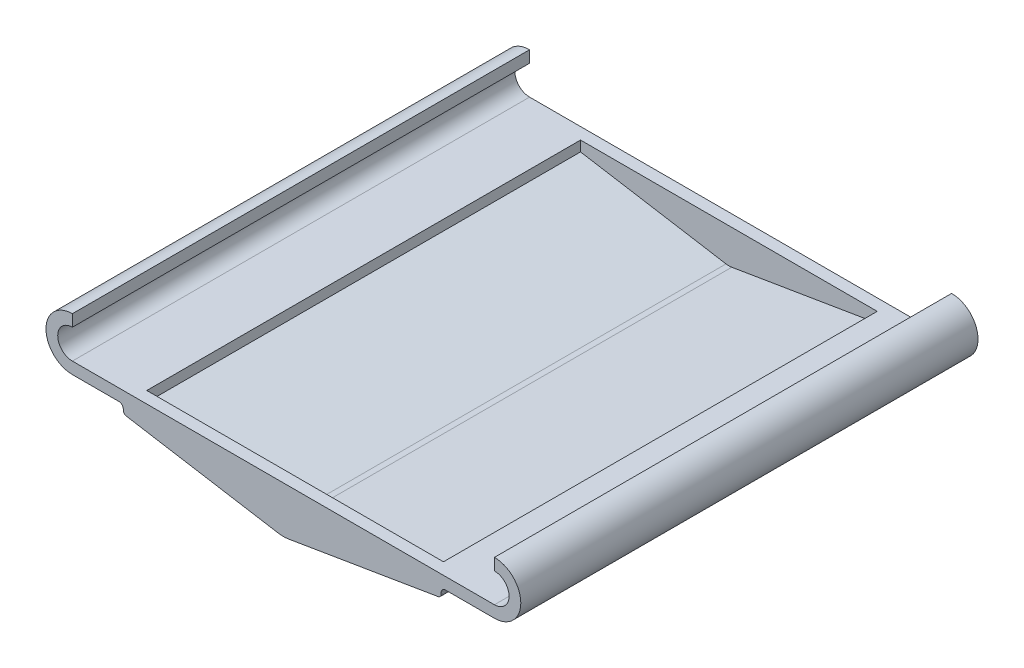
SolidWorks part; units mm, degrees
ref_plane "Plan1" through (0, 0, 0) normal (0, 0, 1) x (1, 0, 0)
ref_plane "Plan2" through (0, 0, 0) normal (0, 1, 0) x (1, 0, 0)
ref_plane "Plan3" through (0, 0, 0) normal (1, 0, 0) x (0, 0, -1)
sketch "Esquisse1" plane through (0, 0, 0) normal (0, 0, 1) x (1, 0, 0)
  line L0 (-7, -36.5) -> (-7, -35) construction
  line L1 (-7, -36.5) -> (-7, -35) construction
  line L2 (-7.5, -34.5) -> (-8.5, -34.5) construction
  line L3 (-7.5, -34.5) -> (-8.5, -34.5) construction
  line L4 (-8.5, -37) -> (-7.5, -37) construction
  line L5 (-8.5, -37) -> (-7.5, -37) construction
  line L6 (-9, -38) -> (-9, -37.5) construction
  line L7 (-9, -38) -> (-9, -37.5) construction
  line L8 (27, -35) -> (27, -36.5) construction
  line L9 (27, -35) -> (27, -36.5) construction
  line L10 (29, -37.5) -> (29, -38) construction
  line L11 (29, -37.5) -> (29, -38) construction
  line L12 (28.5, -37) -> (27.5, -37) construction
  line L13 (28.5, -37) -> (27.5, -37) construction
  line L14 (-8, -39) -> (28, -39) construction
  line L15 (-8, -39) -> (28, -39)
  line L16 (-8, -40) -> (28, -40)
  line L17 (-8, -36.5) -> (-8, -35.5)
  line L18 (28, -35.5) -> (28, -36.5)
  arc A0 (-7, -35) -> (-7.5, -34.5) centre (-7.5, -35) ccw construction
  arc A1 (-7, -35) -> (-7.5, -34.5) centre (-7.5, -35) ccw construction
  arc A2 (-7.5, -37) -> (-7, -36.5) centre (-7.5, -36.5) ccw construction
  arc A3 (-7.5, -37) -> (-7, -36.5) centre (-7.5, -36.5) ccw construction
  arc A4 (-8.5, -37) -> (-9, -37.5) centre (-8.5, -37.5) ccw construction
  arc A5 (-8.5, -37) -> (-9, -37.5) centre (-8.5, -37.5) ccw construction
  arc A6 (-9, -38) -> (-8, -39) centre (-8, -38) ccw construction
  arc A7 (-9, -38) -> (-8, -39) centre (-8, -38) ccw construction
  arc A8 (29, -37.5) -> (28.5, -37) centre (28.5, -37.5) ccw construction
  arc A9 (29, -37.5) -> (28.5, -37) centre (28.5, -37.5) ccw construction
  arc A10 (28, -39) -> (29, -38) centre (28, -38) ccw construction
  arc A11 (28, -39) -> (29, -38) centre (28, -38) ccw construction
  arc A12 (27, -36.5) -> (27.5, -37) centre (27.5, -36.5) ccw construction
  arc A13 (27, -36.5) -> (27.5, -37) centre (27.5, -36.5) ccw construction
  arc A14 (-8, -39) -> (-8, -36.5) centre (-8, -37.75) cw
  arc A15 (28, -39) -> (28, -36.5) centre (28, -37.75) ccw
  arc A16 (28, -40) -> (28, -35.5) centre (28, -37.75) ccw
  arc A17 (-8, -40) -> (-8, -35.5) centre (-8, -37.75) cw
  dimension "D1" = 1.25
  dimension "D2" = 1.25
  dimension "D3" = 1
extrude "Base-Extrusion" add sketch "Esquisse1" along normal mid plane 39
sketch "Esquisse3" plane through (0, 0, 0) normal (0, 0, 1) x (1, 0, 0)
  line L0 (-8, -40) -> (28, -40) construction
  line L1 (-4.0341, -40) -> (23.8333, -40)
  line L2 (-8, -40) -> (-3.7892, -40.7018) construction
  line L3 (10, -43) -> (23.2029, -40.7995)
  line L4 (23.4536, -40.3797) -> (23.4536, -40.5036)
  line L5 (-3.6545, -40.3797) -> (-3.6545, -40.4701)
  line L6 (23.4231, -40.7628) -> (28, -40) construction
  line L7 (-3.4038, -40.766) -> (10, -43)
  arc A0 (23.4536, -40.5036) -> (23.2029, -40.7995) centre (23.1536, -40.5036) cw
  arc A1 (-3.6545, -40.4701) -> (-3.4038, -40.766) centre (-3.3545, -40.4701) ccw
  arc A2 (-3.6545, -40.3797) -> (-4.0341, -40) centre (-4.0341, -40.3797) ccw
  arc A3 (23.4536, -40.3797) -> (23.8333, -40) centre (23.8333, -40.3797) cw
  point P2 (10, -40)
  dimension "D2" = 0.3
  dimension "D1" = 3
extrude "Boss.-Extru.1" add sketch "Esquisse3" along normal mid plane 39
fillet "Congé1" radius 2.5
sketch "Esquisse4" plane through (0, 0, 0) normal (0, 0, 1) x (1, 0, 0)
  line L0 (10.2466, -41.9451) -> (22.6545, -39.8771)
  line L1 (9.7534, -41.9451) -> (-2.6545, -39.8771)
  line L2 (22.6545, -39) -> (22.6545, -39.8771)
  line L3 (-2.6545, -39) -> (-2.6545, -39.8771)
  line L5 (22.6545, -39) -> (-2.6545, -39)
  line L6 (28, -39) -> (-8, -39) construction
  line L9 (-3.4038, -40.766) -> (9.589, -42.9315)
  line L10 (10.411, -42.9315) -> (23.2029, -40.7995)
  line L11 (23.4536, -40.5036) -> (23.4536, -40.3797)
  line L12 (23.8333, -40) -> (28, -40)
  line L13 (28, -35.5) -> (28, -36.5)
  line L14 (28, -39) -> (-8, -39)
  line L15 (-8, -36.5) -> (-8, -35.5)
  line L16 (-8, -40) -> (-4.0341, -40)
  line L17 (-3.6545, -40.3797) -> (-3.6545, -40.4701)
  line L18 (-3.4038, -40.766) -> (9.589, -42.9315) construction
  line L19 (10.411, -42.9315) -> (23.2029, -40.7995) construction
  arc A0 (9.7534, -41.9451) -> (10.2466, -41.9451) centre (10, -40.4655) ccw
  arc A9 (9.589, -42.9315) -> (10.411, -42.9315) centre (10, -40.4655) ccw
  arc A10 (23.2029, -40.7995) -> (23.4536, -40.5036) centre (23.1536, -40.5036) ccw
  arc A11 (23.8333, -40) -> (23.4536, -40.3797) centre (23.8333, -40.3797) ccw
  arc A12 (28, -40) -> (28, -35.5) centre (28, -37.75) ccw
  arc A13 (28, -39) -> (28, -36.5) centre (28, -37.75) ccw
  arc A14 (-8, -36.5) -> (-8, -39) centre (-8, -37.75) ccw
  arc A15 (-8, -35.5) -> (-8, -40) centre (-8, -37.75) ccw
  arc A16 (-3.6545, -40.3797) -> (-4.0341, -40) centre (-4.0341, -40.3797) ccw
  arc A17 (-3.6545, -40.4701) -> (-3.4038, -40.766) centre (-3.3545, -40.4701) ccw
  arc A18 (9.589, -42.9315) -> (10.411, -42.9315) centre (10, -40.4655) ccw construction
  dimension "D4" = 1
  dimension "D1" = 0
  dimension "D2" = 1
extrude "Enlèv. mat.-Extru.1" cut sketch "Esquisse4" against normal mid plane 37
